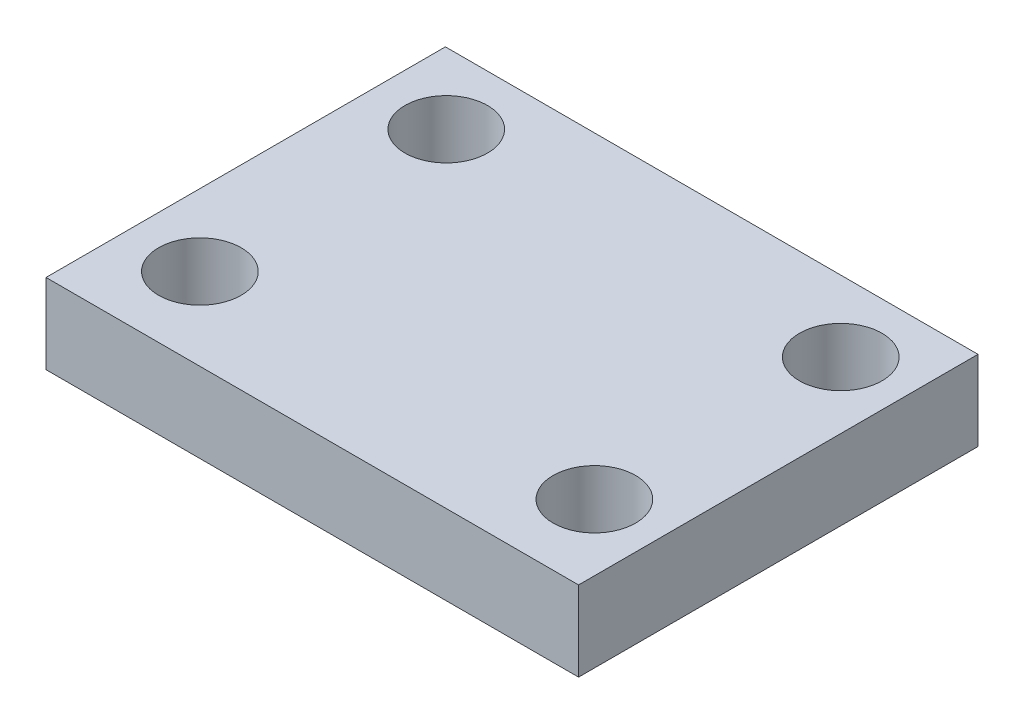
SolidWorks part; units mm, degrees
ref_plane "Front" through (0, 0, 0) normal (0, 0, 1) x (1, 0, 0)
ref_plane "Top" through (0, 0, 0) normal (0, 1, 0) x (1, 0, 0)
ref_plane "Right" through (0, 0, 0) normal (1, 0, 0) x (0, 0, -1)
sketch "Sketch1" plane through (0, 0, 0) normal (0, 1, 0) x (1, 0, 0)
  line L0 (50, -37.5) -> (-50, 37.5) construction
  line L1 (-50, 37.5) -> (50, 37.5)
  line L2 (-50, 37.5) -> (-50, -37.5)
  line L3 (-50, -37.5) -> (50, -37.5)
  line L4 (50, 37.5) -> (50, -37.5)
  dimension "D1" = 100
  dimension "D2" = 75
extrude "Extrude1" add sketch "Sketch1" along normal blind 15
sketch "Sketch6" plane through (0, 15, 0) normal (0, 1, 0) x (-1, 0, 0)
  point P0 (36.5164, -24.1708)
  point P1 (36.5164, 22.0884)
  point P3 (-37.5576, 22.0884)
  point P5 (-37.5576, -24.1708)
hole_wizard "M15.5 (15.5) Diameter Hole1" positions "Sketch8" profile "Sketch7" hole size "M15.5" standard "Ansi Metric"
sketch "Sketch8" plane through (0, 15, 0) normal (0, 1, 0) x (-1, 0, 0)
  point P1 (36.5164, 22.0884)
  point P2 (36.5164, -24.1708)
  point P4 (-37.5576, -24.1708)
  point P6 (-37.5576, 22.0884)
sketch "Sketch7" plane through (-36.5164, 15, 22.0884) normal (1, 0, 0) x (0, 0, 1)
  line L0 (0, 0) -> (0, 15)
  line L1 (0, 15) -> (7.75, 15)
  line L2 (7.75, 15) -> (7.75, 0)
  line L5 (7.75, 0) -> (0, 0)
  line L11 (0, -6.35) -> (0, 107.95) construction
  dimension "Thru Hole Dia." = 15.5
  dimension "Thru Hole Depth" = 15
